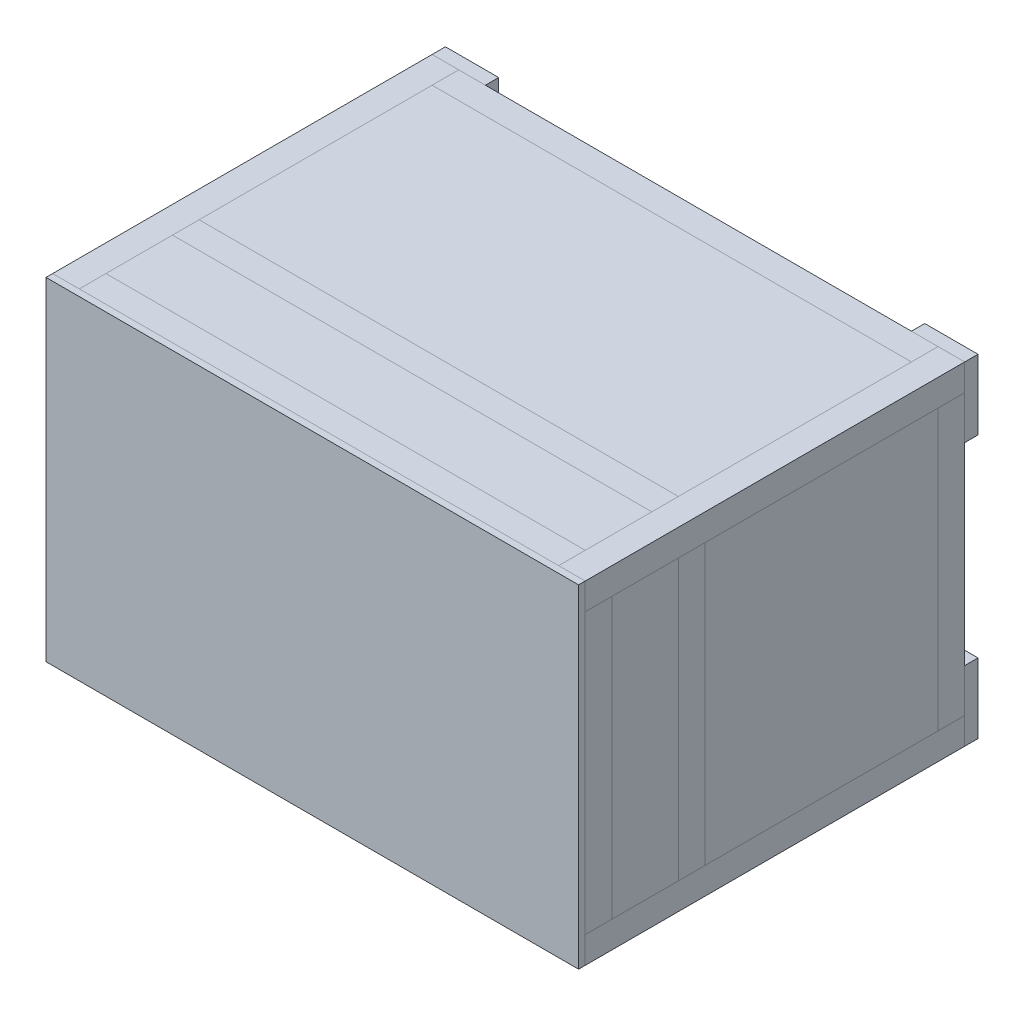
SolidWorks part; units mm, degrees
ref_plane "前视基准面" through (0, 0, 0) normal (0, 0, 1) x (1, 0, 0)
ref_plane "上视基准面" through (0, 0, 0) normal (0, 1, 0) x (1, 0, 0)
ref_plane "右视基准面" through (0, 0, 0) normal (1, 0, 0) x (0, 0, -1)
sketch "草图1" plane through (0, 0, 0) normal (0, 0, 1) x (1, 0, 0)
  line L1 (400, 250) -> (-400, 250)
  line L2 (400, 250) -> (400, -250)
  line L3 (400, -250) -> (-400, -250)
  line L4 (-400, 250) -> (-400, -250)
  line L5 (400, 250) -> (-400, -250) construction
  line L6 (400, -250) -> (-400, 250) construction
  point P0 (0, 0)
  dimension "D1" = 800
  dimension "D2" = 500
extrude "凸台-拉伸1" add sketch "草图1" along normal blind 10
sketch "草图2" plane through (0, 0, 0) normal (0, 0, -1) x (-1, 0, 0)
  line L1 (-400, 250) -> (-360, 250)
  line L2 (-400, 250) -> (-400, 210)
  line L3 (-400, 210) -> (-360, 210)
  line L4 (-360, 250) -> (-360, 210)
  line L5 (400, 250) -> (360, 250)
  line L6 (400, 250) -> (400, 210)
  line L7 (400, 210) -> (360, 210)
  line L8 (360, 250) -> (360, 210)
  line L9 (400, -250) -> (360, -250)
  line L10 (400, -250) -> (400, -210)
  line L11 (400, -210) -> (360, -210)
  line L12 (360, -250) -> (360, -210)
  line L13 (-400, -250) -> (-360, -250)
  line L14 (-400, -250) -> (-400, -210)
  line L15 (-400, -210) -> (-360, -210)
  line L16 (-360, -250) -> (-360, -210)
  dimension "D1" = 40
  dimension "D2" = 40
  dimension "D3" = 40
  dimension "D4" = 40
  dimension "D5" = 40
  dimension "D6" = 40
  dimension "D7" = 40
  dimension "D8" = 40
extrude "凸台-拉伸2" add sketch "草图2" along normal blind 570 separate body
sketch "草图3" plane through (-360, 0, 0) normal (1, 0, 0) x (0, 0, -1)
  line L0 (570, 250) -> (0, 250) construction
  line L1 (0, -250) -> (40, -250)
  line L2 (0, -250) -> (0, -210)
  line L3 (0, -210) -> (40, -210)
  line L4 (40, -250) -> (40, -210)
  line L5 (0, 250) -> (40, 250)
  line L6 (0, 250) -> (0, 210)
  line L7 (0, 210) -> (40, 210)
  line L8 (40, 250) -> (40, 210)
  line L10 (570, -250) -> (530, -250)
  line L11 (570, -250) -> (570, -210)
  line L12 (570, -210) -> (530, -210)
  line L13 (530, -250) -> (530, -210)
  line L14 (570, 210) -> (530, 210)
  line L15 (570, 210) -> (570, 250)
  line L16 (570, 250) -> (530, 250)
  line L17 (530, 210) -> (530, 250)
  dimension "D1" = 40
  dimension "D2" = 40
  dimension "D3" = 40
  dimension "D4" = 40
  dimension "D5" = 40
  dimension "D6" = 40
  dimension "D7" = 40
extrude "凸台-拉伸3" add sketch "草图3" along normal up to surface (720 mm away) separate body
sketch "草图4" plane through (0, -210, 0) normal (0, 1, 0) x (1, 0, 0)
  line L0 (-360, 570) -> (-360, 0) construction
  line L1 (400, 0) -> (360, 0)
  line L2 (400, 0) -> (400, 40)
  line L3 (400, 40) -> (360, 40)
  line L4 (360, 0) -> (360, 40)
  line L5 (-400, 0) -> (-360, 0)
  line L6 (-400, 0) -> (-400, 40)
  line L7 (-400, 40) -> (-360, 40)
  line L8 (-360, 0) -> (-360, 40)
  line L10 (360, 570) -> (400, 570) construction
  line L11 (400, 570) -> (360, 570)
  line L12 (400, 570) -> (400, 530)
  line L13 (400, 530) -> (360, 530)
  line L14 (360, 570) -> (360, 530)
  line L15 (360, 530) -> (-360, 530) construction
  line L16 (-400, 570) -> (-360, 570)
  line L17 (-400, 570) -> (-400, 530)
  line L18 (-400, 530) -> (-360, 530)
  line L19 (-360, 570) -> (-360, 530)
extrude "凸台-拉伸4" add sketch "草图4" along normal up to surface (420 mm away) separate body
sketch "草图5" plane through (360, 0, 0) normal (-1, 0, 0) x (0, 0, 1)
  line L4 (-40, 250) -> (-140, 250) construction
  line L5 (-40, -250) -> (-140, -250) construction
  line L6 (-570, -250) -> (0, -250) construction
  line L8 (-140, 250) -> (-180, 250)
  line L9 (-140, 250) -> (-140, 210)
  line L10 (-140, 210) -> (-180, 210)
  line L11 (-180, 250) -> (-180, 210)
  line L12 (-140, -250) -> (-180, -250)
  line L13 (-140, -250) -> (-140, -210)
  line L14 (-140, -210) -> (-180, -210)
  line L15 (-180, -250) -> (-180, -210)
  dimension "D1" = 40
  dimension "D2" = 40
  dimension "D3" = 40
  dimension "D4" = 40
extrude "凸台-拉伸5" add sketch "草图5" along normal up to surface (720 mm away) separate body
sketch "草图6" plane through (0, -210, 0) normal (0, 1, 0) x (1, 0, 0)
  line L1 (360, 140) -> (400, 140)
  line L2 (360, 140) -> (360, 180)
  line L3 (360, 180) -> (400, 180)
  line L4 (400, 140) -> (400, 180)
  line L5 (-360, 140) -> (-400, 140)
  line L6 (-360, 140) -> (-360, 180)
  line L7 (-360, 180) -> (-400, 180)
  line L8 (-400, 140) -> (-400, 180)
  dimension "D1" = 40
  dimension "D2" = 40
  dimension "D3" = 40
  dimension "D4" = 40
extrude "凸台-拉伸6" add sketch "草图6" along normal up to surface (420 mm away) separate body
sketch "草图7" plane through (400, 0, 0) normal (1, 0, 0) x (0, 0, -1)
  line L0 (530, 210) -> (530, -210) construction
  line L1 (570, 210) -> (0, 210) construction
  line L2 (180, 210) -> (180, -210) construction
  line L3 (140, 210) -> (140, -210) construction
  line L4 (570, -210) -> (0, -210) construction
  line L5 (40, 210) -> (40, -210) construction
  line L6 (530, 210) -> (530, -210)
  line L7 (530, 210) -> (180, 210)
  line L8 (180, 210) -> (180, -210)
  line L9 (140, 210) -> (140, -210)
  line L10 (530, -210) -> (180, -210)
  line L11 (40, 210) -> (40, -210)
  line L12 (140, 210) -> (40, 210)
  line L13 (140, -210) -> (40, -210)
extrude "凸台-拉伸7" add sketch "草图7" against normal blind 2 separate body
sketch "草图8" plane through (-400, 0, 0) normal (-1, 0, 0) x (0, 0, 1)
  line L0 (-40, 210) -> (-140, 210) construction
  line L1 (-140, 210) -> (-140, -210) construction
  line L2 (-140, -210) -> (-40, -210) construction
  line L3 (-40, -210) -> (-40, 210) construction
  line L4 (-180, 210) -> (-530, 210) construction
  line L5 (-530, 210) -> (-530, -210) construction
  line L6 (-530, -210) -> (-180, -210) construction
  line L7 (-180, -210) -> (-180, 210) construction
  line L8 (-40, 210) -> (-140, 210)
  line L9 (-140, 210) -> (-140, -210)
  line L10 (-140, -210) -> (-40, -210)
  line L11 (-40, -210) -> (-40, 210)
  line L12 (-180, 210) -> (-530, 210)
  line L13 (-530, 210) -> (-530, -210)
  line L14 (-530, -210) -> (-180, -210)
  line L15 (-180, -210) -> (-180, 210)
extrude "凸台-拉伸8" add sketch "草图8" against normal blind 2 separate body
sketch "草图9" plane through (0, 250, 0) normal (0, 1, 0) x (1, 0, 0)
  line L0 (-360, 570) -> (-360, 0) construction
  line L1 (360, 570) -> (360, 0) construction
  line L2 (360, 40) -> (-360, 40) construction
  line L3 (360, 530) -> (-360, 530) construction
  line L4 (-360, 180) -> (360, 180) construction
  line L5 (-360, 140) -> (360, 140) construction
  line L6 (-360, 530) -> (-360, 180)
  line L7 (360, 530) -> (360, 180)
  line L8 (360, 40) -> (-360, 40)
  line L9 (360, 530) -> (-360, 530)
  line L10 (-360, 180) -> (360, 180)
  line L11 (-360, 140) -> (360, 140)
  line L12 (-360, 140) -> (-360, 40)
  line L13 (360, 140) -> (360, 40)
extrude "凸台-拉伸9" add sketch "草图9" against normal blind 2 separate body
ref_plane "基准面1" through (90, 0, 0) normal (-1, 0, 0) x (0, 0, 1)
sketch "草图10" plane through (90, 0, 0) normal (-1, 0, 0) x (0, 0, 1)
  line L0 (-40, -250) -> (-40, -210) construction
  line L1 (-140, -250) -> (-140, -210) construction
  line L2 (-40, -250) -> (-40, -210)
  line L3 (-140, -250) -> (-140, -210)
  line L4 (0, -250) -> (0, -210)
  line L5 (0, -210) -> (-570, -210)
  line L6 (-570, -210) -> (-570, -250)
  line L7 (-570, -250) -> (0, -250)
  line L9 (-40, -210) -> (-140, -210)
  line L11 (-140, -250) -> (-40, -250)
  dimension "D1" = 0
extrude "凸台-拉伸10" add sketch "草图10" along normal blind 40 separate body
sketch "草图11" plane through (0, 0, -570) normal (0, 0, -1) x (-1, 0, 0)
  line L1 (400, -250) -> (320, -250)
  line L2 (400, -250) -> (400, -145)
  line L3 (400, -145) -> (320, -145)
  line L4 (320, -250) -> (320, -145)
  line L5 (-400, -250) -> (-320, -250)
  line L6 (-400, -250) -> (-400, -145)
  line L7 (-400, -145) -> (-320, -145)
  line L8 (-320, -250) -> (-320, -145)
  line L9 (400, 250) -> (320, 250)
  line L10 (400, 250) -> (400, 145)
  line L11 (400, 145) -> (320, 145)
  line L12 (320, 250) -> (320, 145)
  line L13 (-400, 250) -> (-320, 250)
  line L14 (-400, 250) -> (-400, 145)
  line L15 (-400, 145) -> (-320, 145)
  line L16 (-320, 250) -> (-320, 145)
  dimension "D1" = 80
  dimension "D2" = 105
  dimension "D3" = 105
  dimension "D4" = 80
  dimension "D5" = 105
  dimension "D6" = 80
  dimension "D7" = 80
  dimension "D8" = 105
extrude "凸台-拉伸14" add sketch "草图11" along normal blind 20 separate body
sketch "草图14" plane through (0, -250, 0) normal (0, -1, 0) x (1, 0, 0)
  line L0 (90, -140) -> (90, -40) construction
  line L2 (50, -40) -> (50, -140) construction
  line L4 (-360, -530) -> (360, -530) construction
  line L5 (360, -530) -> (360, -180) construction
  line L6 (360, -180) -> (-360, -180) construction
  line L7 (-360, -180) -> (-360, -530) construction
  line L8 (360, -140) -> (360, -40) construction
  line L9 (360, -40) -> (-360, -40) construction
  line L10 (-360, -40) -> (-360, -140) construction
  line L11 (-360, -140) -> (360, -140) construction
  line L12 (90, -140) -> (90, -40)
  line L13 (50, -40) -> (-360, -40)
  line L14 (50, -40) -> (50, -140)
  line L15 (90, -140) -> (360, -140)
  line L16 (-360, -530) -> (-0.5, -530)
  line L17 (360, -530) -> (360, -180)
  line L18 (360, -180) -> (0.5, -180)
  line L19 (-360, -180) -> (-360, -530)
  line L20 (360, -140) -> (360, -40)
  line L21 (360, -40) -> (90, -40)
  line L22 (-360, -40) -> (-360, -140)
  line L23 (-360, -140) -> (50, -140)
  line L24 (0, -180) -> (0, -530) construction
  line L25 (-0.5, -180) -> (-0.5, -530)
  line L26 (-0.5, -180) -> (-360, -180)
  line L27 (0.5, -530) -> (360, -530)
  line L28 (0.5, -180) -> (0.5, -530)
  line L30 (0.5, -108.7424) -> (-0.5, -601.2576) construction
  line L31 (0.5, -601.2576) -> (-0.5, -108.7424) construction
  point P13 (0, -355)
  dimension "D1" = 1
extrude "凸台-拉伸15" add sketch "草图14" against normal blind 1 separate body
sketch "草图15" plane through (0, -250, 0) normal (0, -1, 0) x (1, 0, 0)
  line L0 (360, -570) -> (360, 0) construction
  line L1 (360, -40) -> (-360, -40) construction
  circle A0 centre (320, -75) radius 17.5
  dimension "D1" = 40
  dimension "D2" = 35
extrude "凸台-拉伸16" add sketch "草图15" along normal blind 15 separate body
sketch "草图16" plane through (0, -250, 0) normal (0, -1, 0) x (1, 0, 0)
  line L0 (0.5, -355) -> (20.5, -355) construction
  line L1 (0.5, -180) -> (0.5, -530) construction
  line L2 (-0.5, -355) -> (-20.5, -355) construction
  line L3 (-0.5, -530) -> (-0.5, -180) construction
  line L4 (20.5, -300) -> (20.5, -410)
  line L5 (20.5, -410) -> (65.5, -410)
  line L6 (65.5, -410) -> (65.5, -300)
  line L7 (65.5, -300) -> (20.5, -300)
  line L8 (20.5, -355) -> (35.5, -355) construction
  line L9 (35.5, -307.5) -> (35.5, -402.5)
  line L10 (35.5, -402.5) -> (55.5, -402.5)
  line L11 (55.5, -402.5) -> (55.5, -307.5)
  line L12 (55.5, -307.5) -> (35.5, -307.5)
  line L13 (0, -180) -> (0, -185.1055) construction
  line L14 (-155, -60) -> (-155, -75) construction
  line L15 (-360, -180) -> (360, -180) construction
  line L16 (-35.5, -402.5) -> (-55.5, -402.5)
  line L17 (-20.5, -410) -> (-65.5, -410)
  line L18 (-55.5, -307.5) -> (-35.5, -307.5)
  line L19 (-35.5, -307.5) -> (-35.5, -402.5)
  line L20 (-65.5, -300) -> (-20.5, -300)
  line L21 (-20.5, -300) -> (-20.5, -410)
  line L22 (-55.5, -402.5) -> (-55.5, -307.5)
  line L23 (-65.5, -410) -> (-65.5, -300)
  line L24 (0, -40) -> (0, -60) construction
  line L25 (360, -40) -> (-360, -40) construction
  line L26 (-336.6417, -60) -> (26.6417, -60) construction
  line L29 (-210, -105) -> (-100, -105)
  line L30 (-100, -105) -> (-100, -60)
  line L31 (-100, -60) -> (-210, -60)
  line L32 (-210, -60) -> (-210, -105)
  line L33 (-202.5, -75) -> (-107.5, -75)
  line L34 (-107.5, -75) -> (-107.5, -95)
  line L35 (-107.5, -95) -> (-202.5, -95)
  line L36 (-202.5, -95) -> (-202.5, -75)
extrude "凸台-拉伸17" add sketch "草图16" along normal blind 5 separate body
sketch "草图17" plane through (0, 0, -570) normal (0, 0, -1) x (-1, 0, 0)
  line L0 (-360, 210) -> (-360, -210) construction
  line L2 (-360, 210) -> (360, 210) construction
  line L3 (360, 210) -> (360, -210) construction
  line L4 (-360, 210) -> (-360, -210)
  line L5 (-360, -210) -> (360, -210) construction
  line L6 (-360, 210) -> (360, 210)
  line L7 (360, 210) -> (360, -210)
  line L8 (-360, -210) -> (360, -210)
extrude "凸台-拉伸18" add sketch "草图17" against normal blind 1.2 separate body
chamfer "倒角1" distance 10 angle 20 1 edges at (320, -265, -92.5)
